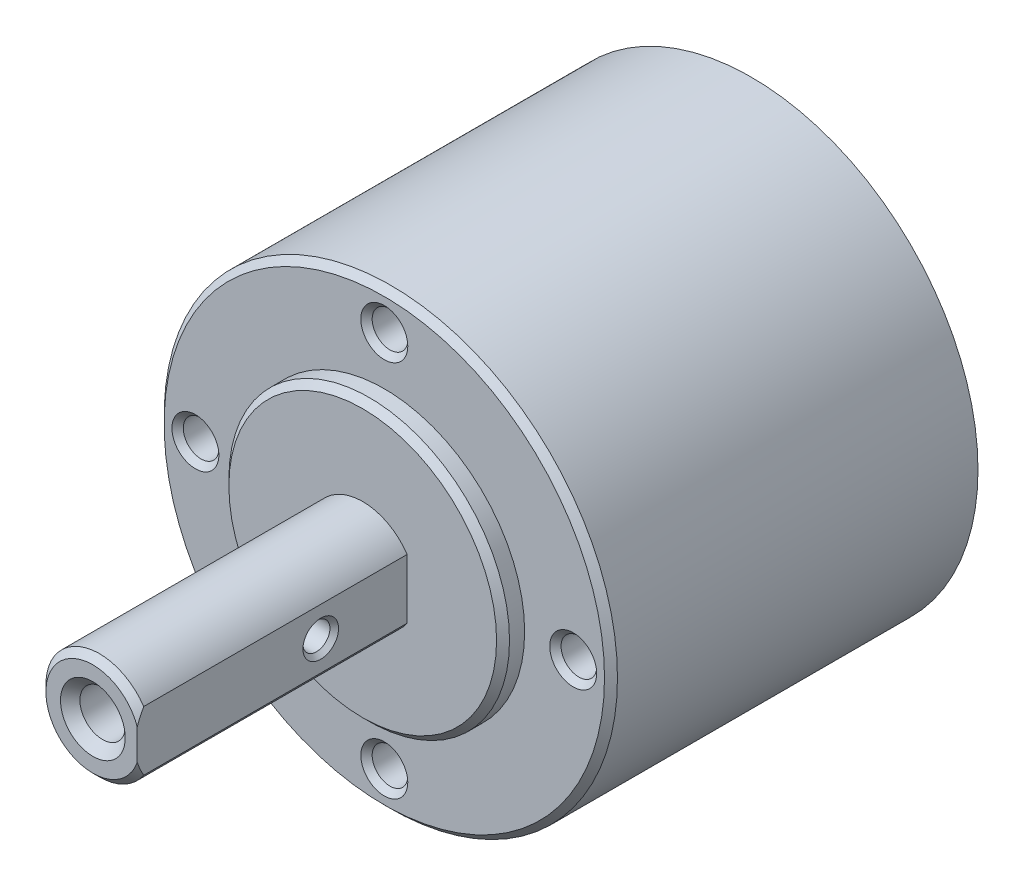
SolidWorks part; units mm, degrees
ref_plane "前视基准面" through (0, 0, 0) normal (0, 0, 1) x (1, 0, 0)
ref_plane "上视基准面" through (0, 0, 0) normal (0, 1, 0) x (1, 0, 0)
ref_plane "右视基准面" through (0, 0, 0) normal (1, 0, 0) x (0, 0, -1)
sketch "草图1" plane through (0, 0, 0) normal (0, 0, 1) x (1, 0, 0)
  circle A0 centre (0, 0) radius 21
  dimension "D1" = 42
extrude "凸台-拉伸1" add sketch "草图1" along normal blind 34
sketch "草图2" plane through (0, 0, 34) normal (0, 0, 1) x (1, 0, 0)
  circle A0 centre (0, 0) radius 13
  dimension "D1" = 26
extrude "凸台-拉伸2" add sketch "草图2" along normal blind 2
sketch "草图3" plane through (0, 0, 34) normal (0, 0, 1) x (1, 0, 0)
  circle A0 centre (0, 0) radius 17.5 construction
  circle A1 centre (0, 17.5) radius 2
  circle A2 centre (17.5, 0) radius 2
  circle A3 centre (0, -17.5) radius 2
  circle A4 centre (-17.5, 0) radius 2
  point P14 (0, 0)
  dimension "D1" = 35
  dimension "D2" = 4
sketch "草图4" plane through (0, 0, 36) normal (0, 0, 1) x (1, 0, 0)
  circle A0 centre (0, 0) radius 4.95
  circle A1 centre (0, 0) radius 13 construction
  dimension "D1" = 9.9
  dimension "D2" = 0
extrude "凸台-拉伸4" add sketch "草图4" along normal blind 25 contours A0
sketch "草图6" plane through (0, 0, 61) normal (0, 0, 1) x (1, 0, 0)
  line L1 (4.1111, -2.757) -> (4.1111, 2.757)
  arc A0 (4.1111, -2.757) -> (4.1111, 2.757) centre (0, 0) ccw
  circle A1 centre (0, 0) radius 4.95 construction
  dimension "D1" = 0
extrude "切除-拉伸3" cut sketch "草图6" against normal blind 25
sketch "草图7" plane through (0, 0, 61) normal (0, 0, 1) x (1, 0, 0)
  circle A0 centre (0, 0) radius 1.7288
hole_wizard "M5 螺纹孔1" positions "3D草图1" profile "草图8" tap size "M5" standard "GB"
sketch3d "3D草图1"
  point P0 (0, 0, 0)
  point P3 (0, 0, 61)
  point P6 (0, 0, 61)
  point P8 (0, 0, 61)
sketch "草图8" plane through (0, 0, 61) normal (1, 0, 0) x (0, -1, 0)
  line L0 (0, 0) -> (0, 15.2618)
  line L1 (0, 15.2618) -> (2.1, 14)
  line L2 (2.1, 14) -> (2.1, 0.9)
  line L3 (2.1, 0.9) -> (3, 0)
  line L5 (3, 0) -> (0, 0)
  line L6 (-2.1, 0.9) -> (-3, 0) construction
  line L10 (0, 15.2618) -> (-2.1, 14) construction
  line L11 (0, -6.35) -> (0, 107.95) construction
  dimension "螺纹孔钻头直径" = 4.2
  dimension "螺纹孔钻头深度" = 14
  dimension "近端锥形沉头孔直径" = 6
  dimension "近端锥形沉头孔角度" = 90
  dimension "导头角度" = 118
sketch "草图9" plane through (4.1111, 0, 0) normal (1, 0, 0) x (0, 0, -1)
  line L0 (-61, 4.95) -> (-61, -4.95) construction
  circle A0 centre (-44, 0) radius 1
  dimension "D1" = 2
  dimension "D2" = 17
hole_wizard "M3 螺纹孔1" positions "3D草图2" profile "草图10" tap size "M3" standard "GB"
sketch3d "3D草图2"
  point P0 (4.1111, 0, 44)
sketch "草图10" plane through (4.1111, 0, 44) normal (0, 1, 0) x (0, 0, -1)
  line L0 (0, 0) -> (0, 25.1111)
  line L1 (0, 25.1111) -> (1.25, 25.1111)
  line L2 (1.25, 25.1111) -> (1.25, 0.4)
  line L3 (1.25, 0.4) -> (1.65, 0)
  line L5 (1.65, 0) -> (0, 0)
  line L6 (-1.25, 0.4) -> (-1.65, 0) construction
  line L11 (0, -6.35) -> (0, 107.95) construction
  dimension "通孔螺纹孔钻头直径" = 2.5
  dimension "通孔螺纹孔钻头深度" = 25.1111
  dimension "近端锥形沉头孔直径" = 3.3
  dimension "近端锥形沉头孔角度" = 90
chamfer "倒角1" distance 0.6 angle 45 3 edges at (21, 0, 34) (13, 0, 36) (-4.95, 0, 61)
hole_wizard "M4 螺纹孔1" positions "3D草图3" profile "草图11" tap size "M4" standard "GB"
sketch3d "3D草图3"
  point P0 (0, 17.5, 34)
  point P5 (0, -17.5, 34)
  point P8 (-17.5, 0, 34)
  point P13 (17.5, 0, 34)
sketch "草图11" plane through (0, 17.5, 34) normal (1, 0, 0) x (0, -1, 0)
  line L0 (0, 0) -> (0, 12.4914)
  line L1 (0, 12.4914) -> (1.65, 11.5)
  line L2 (1.65, 11.5) -> (1.65, 0.525)
  line L3 (1.65, 0.525) -> (2.175, 0)
  line L5 (2.175, 0) -> (0, 0)
  line L6 (-1.65, 0.525) -> (-2.175, 0) construction
  line L10 (0, 12.4914) -> (-1.65, 11.5) construction
  line L11 (0, -6.35) -> (0, 107.95) construction
  dimension "螺纹孔钻头直径" = 3.3
  dimension "螺纹孔钻头深度" = 11.5
  dimension "近端锥形沉头孔直径" = 4.35
  dimension "近端锥形沉头孔角度" = 90
  dimension "导头角度" = 118
